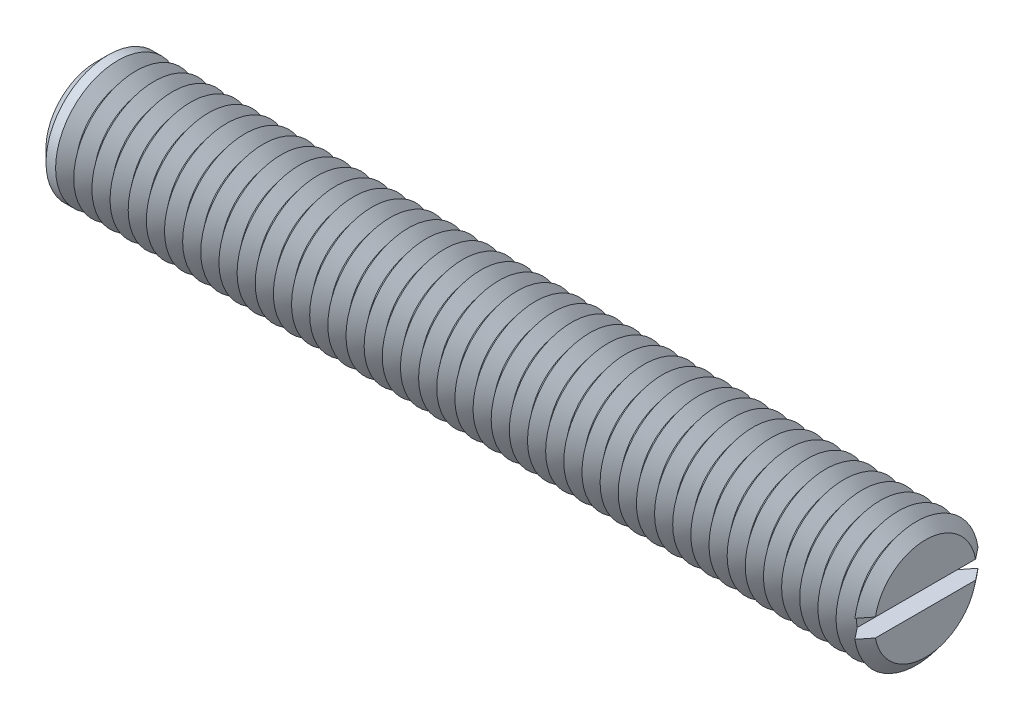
SolidWorks part; units mm, degrees
ref_plane "Front Plane" through (0, 0, 0) normal (0, 0, 1) x (1, 0, 0)
ref_plane "Top Plane" through (0, 0, 0) normal (0, 1, 0) x (1, 0, 0)
ref_plane "Right Plane" through (0, 0, 0) normal (1, 0, 0) x (0, 0, -1)
sketch "Sketch1" plane through (0, 0, 0) normal (1, 0, 0) x (0, 0, -1)
  circle A0 centre (0, 0) radius 6
  dimension "D1" = 12
extrude "Extrude1" add sketch "Sketch1" along normal mid plane 80
sketch "Sketch2" plane through (0, 0, 0) normal (0, 0, 1) x (1, 0, 0)
  line L0 (40, 0.875) -> (38.25, 0.875)
  line L1 (40, -6) -> (40, 6) construction
  line L2 (38.25, 0.875) -> (38.25, -0.875)
  line L3 (0, 0) -> (50000, 0) construction
  line L4 (40, -0.875) -> (38.25, -0.875)
  line L5 (40, -0.875) -> (40, 0.875)
  point P9 (38.25, 0)
  dimension "D1" = 1.75
extrude "Extrude2" cut sketch "Sketch2" against normal mid plane 18
chamfer "Chamfer1" distance 1.2 angle 45 1 edges at (-40, 0, -6)
sketch "Sketch3" plane through (0, 0, 0) normal (0, 0, 1) x (1, 0, 0)
  line L0 (0, 0) -> (30.9602, 0) construction
  line L1 (39.125, -6) -> (40.875, -6)
  line L2 (-38.8, -6) -> (40, -6) construction
  line L3 (40.875, -6) -> (40, -4.9071)
  line L4 (40, -6) -> (40, -0.875) construction
  line L5 (40, -4.9071) -> (39.125, -6)
  dimension "D1" = 1.75
  dimension "D2" = 1.4
revolve "Cut-Revolve1" cut sketch "Sketch3" angle 360 about L0
pattern_linear "LPattern1" count 45 spacing 1.75 along (-1, 0, 0) of "Cut-Revolve1"
equation "\"D2@Sketch3\" = \"D1@Sketch3\"*0.8"
